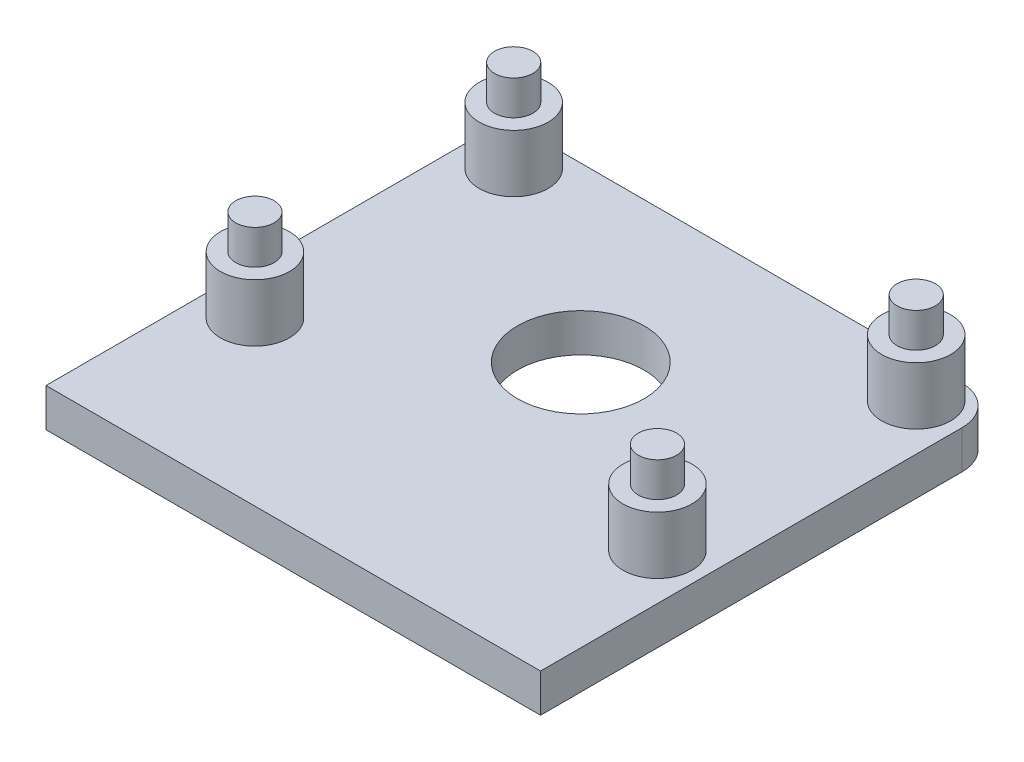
SolidWorks part; units mm, degrees
ref_plane "前视基准面" through (0, 0, 0) normal (0, 0, 1) x (1, 0, 0)
ref_plane "上视基准面" through (0, 0, 0) normal (0, 1, 0) x (1, 0, 0)
ref_plane "右视基准面" through (0, 0, 0) normal (1, 0, 0) x (0, 0, -1)
sketch "草图1" plane through (0, 0, 0) normal (0, 1, 0) x (1, 0, 0)
  line L1 (-13.8705, 15.1218) -> (11.9295, 15.1218)
  line L2 (-13.8705, 15.1218) -> (-13.8705, -8.8782)
  line L3 (-13.8705, -8.8782) -> (11.9295, -8.8782)
  line L4 (11.9295, 15.1218) -> (11.9295, -8.8782)
  line L5 (-13.8705, 15.1218) -> (11.9295, -8.8782) construction
  line L6 (-13.8705, -8.8782) -> (11.9295, 15.1218) construction
  circle A0 centre (-0.9705, 6.1218) radius 3.3
  point P0 (0, 0)
  point P1 (-0.9705, 3.1218)
  dimension "D3" = 6.6
  dimension "D4" = 9
  dimension "D1" = 25.8
  dimension "D2" = 24
extrude "凸台-拉伸1" add sketch "草图1" along normal blind 2
sketch "草图2" plane through (0, 2, 0) normal (0, 1, 0) x (1, 0, 0)
  line L0 (11.9295, 15.1218) -> (-13.8705, 15.1218) construction
  line L1 (-13.8705, 15.1218) -> (-13.8705, -8.8782) construction
  circle A0 centre (-11.4705, 13.1218) radius 1
  circle A1 centre (9.5295, 13.1218) radius 1
  circle A2 centre (-11.4705, -0.3782) radius 1
  circle A3 centre (9.5295, -0.3782) radius 1
  dimension "D1" = 2
  dimension "D2" = 21
  dimension "D3" = 13.5
  dimension "D4" = 2
  dimension "D5" = 2.4
extrude "凸台-拉伸2" add sketch "草图2" along normal blind 4.8
fillet "圆角1" radius 2 2 edges at (11.9295, 1, -15.1218) (-13.8705, 1, -15.1218)
sketch "草图3" plane through (0, 2, 0) normal (0, 1, 0) x (1, 0, 0)
  circle A0 centre (-11.4705, 13.1218) radius 1.8
  circle A1 centre (9.5295, 13.1218) radius 1.8
  circle A2 centre (-11.4705, -0.3782) radius 1.8
  circle A3 centre (9.5295, -0.3782) radius 1.8
  dimension "D1" = 3.6
extrude "凸台-拉伸3" add sketch "草图3" along normal blind 3
